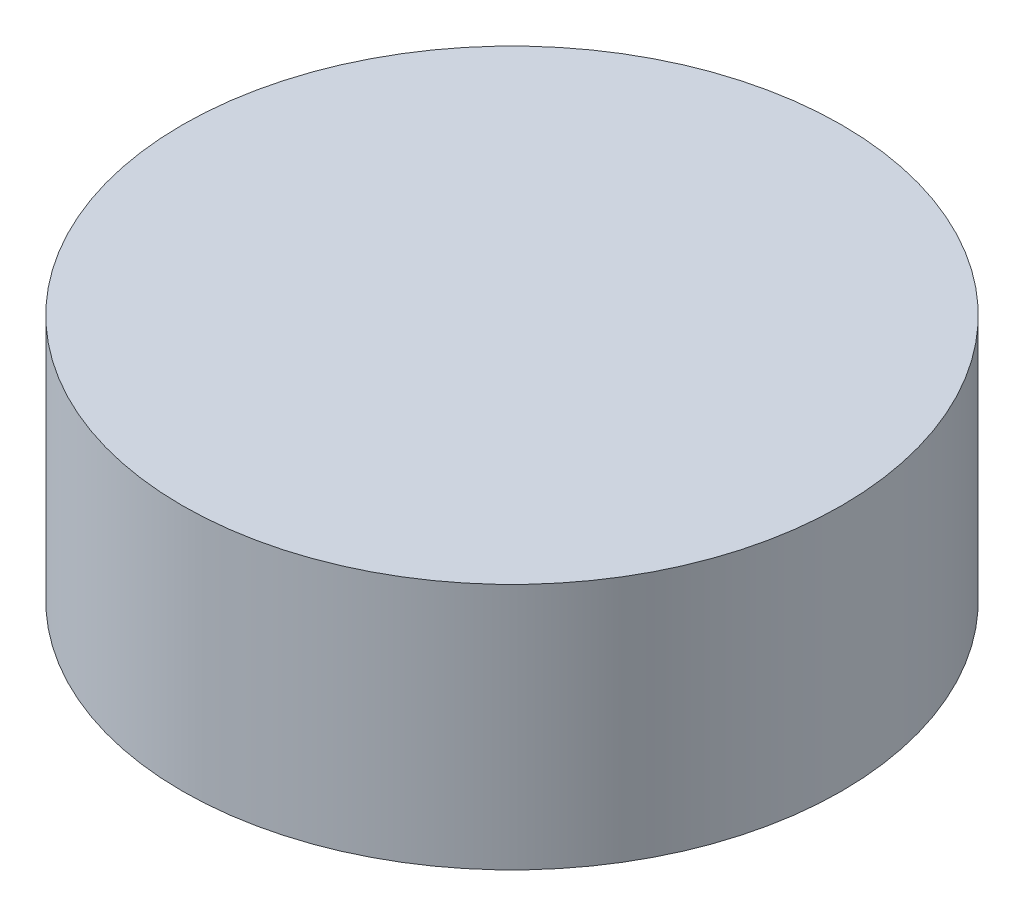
SolidWorks part; units mm, degrees
ref_plane "Front Plane" through (0, 0, 0) normal (0, 0, 1) x (1, 0, 0)
ref_plane "Top Plane" through (0, 0, 0) normal (0, 1, 0) x (1, 0, 0)
ref_plane "Right Plane" through (0, 0, 0) normal (1, 0, 0) x (0, 0, -1)
sketch "Sketch1" plane through (0, 0, 0) normal (0, 1, 0) x (1, 0, 0)
  circle A0 centre (0, 0) radius 4.064
  dimension "D1" = 8.128
extrude "Boss-Extrude1" add sketch "Sketch1" along normal blind 3.048
